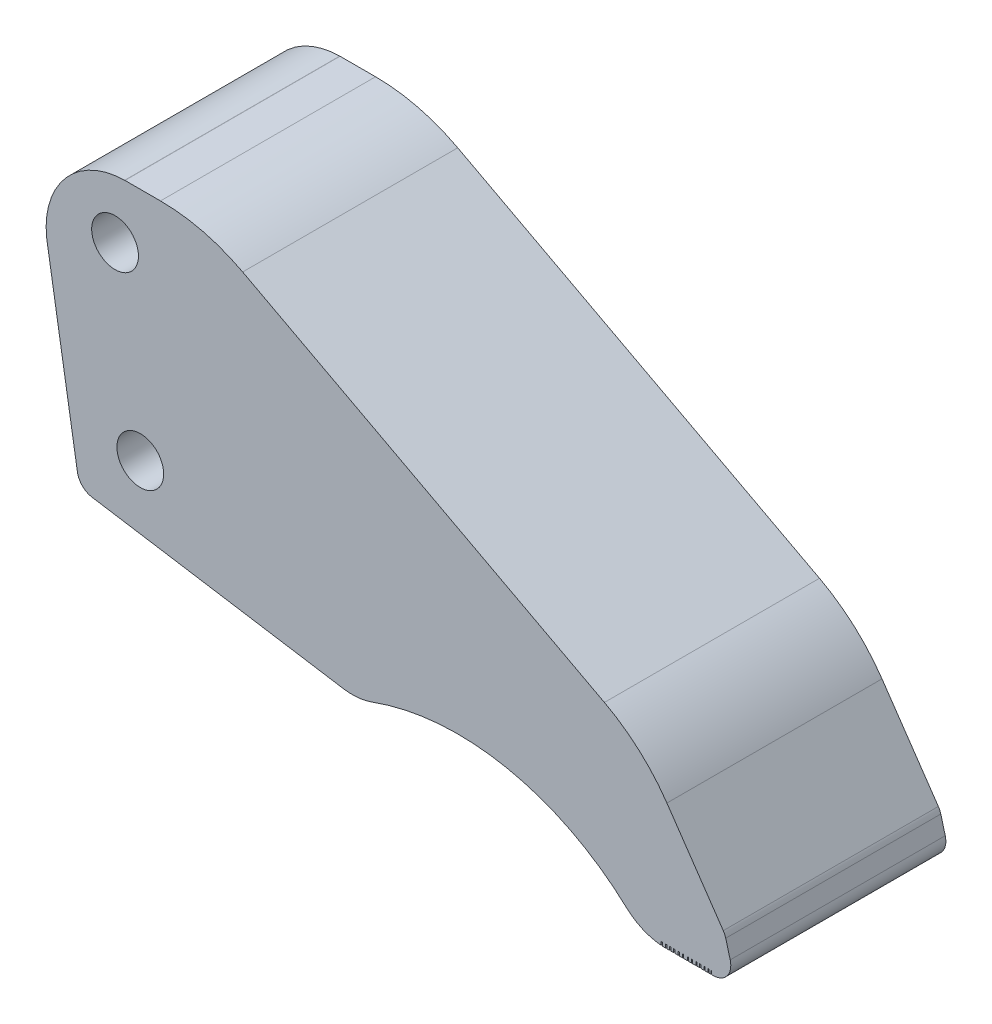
SolidWorks part; units mm, degrees
ref_plane "Front Plane" through (0, 0, 0) normal (0, 0, 1) x (1, 0, 0)
ref_plane "Top Plane" through (0, 0, 0) normal (0, 1, 0) x (1, 0, 0)
ref_plane "Right Plane" through (0, 0, 0) normal (1, 0, 0) x (0, 0, -1)
sketch "Sketch1" plane through (0, 0, 0) normal (0, 0, 1) x (1, 0, 0)
  line L0 (0, 0) -> (42.98, -6.863)
  line L1 (-2.4872, 2.4759) -> (-7.7391, 34.4271)
  line L2 (5.6424, 49.761) -> (11.7224, 49.761)
  line L3 (25.782, 46.2625) -> (87.6805, 13.4239)
  line L4 (98.3784, 3.8655) -> (108.019, -10.2215)
  line L6 (106.3066, -17.7446) -> (98.2366, -17.7446)
  line L7 (109.203, -13.963) -> (108.4396, -11.1342)
  line L8 (106.3066, -17.7446) -> (106.3066, -17.138)
  line L9 (106.3066, -17.138) -> (96.8886, -17.138)
  line L10 (96.8886, -17.138) -> (96.8886, -17.6533)
  line L12 (96.8886, -17.138) -> (97.3722, -17.138)
  line L13 (96.8886, -17.138) -> (96.8886, -17.6533)
  line L15 (97.3722, -17.138) -> (97.3722, -17.7072)
  line L16 (97.6535, -17.138) -> (98.1601, -17.138)
  line L17 (97.6535, -17.138) -> (97.6535, -17.7276)
  line L19 (98.1601, -17.138) -> (98.1601, -17.7443)
  line L20 (98.3784, -17.138) -> (98.822, -17.138)
  line L21 (98.3784, -17.138) -> (98.3784, -17.7446)
  line L22 (98.3784, -17.7446) -> (98.822, -17.7446)
  line L23 (98.822, -17.138) -> (98.822, -17.7446)
  line L24 (99.0508, -17.138) -> (99.4921, -17.138)
  line L25 (99.0508, -17.138) -> (99.0508, -17.7446)
  line L26 (99.0508, -17.7446) -> (99.4921, -17.7446)
  line L27 (99.4921, -17.138) -> (99.4921, -17.7446)
  line L28 (99.77, -17.138) -> (100.3093, -17.138)
  line L29 (99.77, -17.138) -> (99.77, -17.7446)
  line L30 (99.77, -17.7446) -> (100.3093, -17.7446)
  line L31 (100.3093, -17.138) -> (100.3093, -17.7446)
  line L32 (100.5218, -17.138) -> (101.0693, -17.138)
  line L33 (100.5218, -17.138) -> (100.5218, -17.7446)
  line L34 (100.5218, -17.7446) -> (101.0693, -17.7446)
  line L35 (101.0693, -17.138) -> (101.0693, -17.7446)
  line L36 (101.1918, -17.138) -> (101.8783, -17.138)
  line L37 (101.1918, -17.138) -> (101.1918, -17.7446)
  line L38 (101.1918, -17.7446) -> (101.8783, -17.7446)
  line L39 (101.8783, -17.138) -> (101.8783, -17.7446)
  line L40 (102.0499, -17.138) -> (102.5974, -17.138)
  line L41 (102.0499, -17.138) -> (102.0499, -17.7446)
  line L42 (102.0499, -17.7446) -> (102.5974, -17.7446)
  line L43 (102.5974, -17.138) -> (102.5974, -17.7446)
  line L44 (102.7132, -17.138) -> (103.3211, -17.138)
  line L45 (102.7132, -17.138) -> (102.7132, -17.7446)
  line L46 (102.7132, -17.7446) -> (103.3211, -17.7446)
  line L47 (103.3211, -17.138) -> (103.3211, -17.7446)
  line L48 (103.5047, -17.138) -> (103.9775, -17.138)
  line L49 (103.5047, -17.138) -> (103.5047, -17.7446)
  line L50 (103.5047, -17.7446) -> (103.9775, -17.7446)
  line L51 (103.9775, -17.138) -> (103.9775, -17.7446)
  line L52 (104.1802, -17.138) -> (104.682, -17.138)
  line L53 (104.1802, -17.138) -> (104.1802, -17.7446)
  line L54 (104.1802, -17.7446) -> (104.682, -17.7446)
  line L55 (104.682, -17.138) -> (104.682, -17.7446)
  line L56 (104.8557, -17.138) -> (105.4154, -17.138)
  line L57 (104.8557, -17.138) -> (104.8557, -17.7446)
  line L58 (104.8557, -17.7446) -> (105.4154, -17.7446)
  line L59 (105.4154, -17.138) -> (105.4154, -17.7446)
  line L60 (105.5432, -17.138) -> (105.8786, -17.138)
  line L61 (105.5432, -17.138) -> (105.5432, -17.7446)
  line L62 (105.5432, -17.7446) -> (105.8786, -17.7446)
  line L63 (105.8786, -17.138) -> (105.8786, -17.7446)
  line L64 (105.9847, -17.138) -> (106.3066, -17.138)
  line L65 (105.9847, -17.138) -> (105.9847, -17.7446)
  line L66 (105.9847, -17.7446) -> (106.3066, -17.7446)
  line L67 (106.3066, -17.138) -> (106.3066, -17.7446)
  arc A0 (0, 0) -> (-2.4872, 2.4759) centre (0.473, 2.9625) cw
  arc A1 (-7.7391, 34.4271) -> (-7.7605, 34.5823) centre (-4.7789, 34.9137) cw
  arc A4 (5.5908, 49.7606) -> (5.6424, 49.761) centre (5.6424, 46.761) cw
  arc A5 (11.7224, 49.761) -> (25.782, 46.2625) centre (11.7224, 19.761) cw
  arc A6 (87.6805, 13.4239) -> (98.3784, 3.8655) centre (73.6209, -13.0776) cw
  arc A7 (108.019, -10.2215) -> (108.4396, -11.1342) centre (105.5432, -11.9158) cw
  arc A8 (109.203, -13.963) -> (106.3066, -17.7446) centre (106.3066, -14.7446) cw
  arc A9 (98.2366, -17.7446) -> (91.4468, -15.0862) centre (98.2366, -7.7446) cw
  arc A10 (91.4468, -15.0862) -> (47.9937, -6.379) centre (62.5971, -46.2806) ccw
  arc A14 (42.98, -6.863) -> (47.9937, -6.379) centre (44.5568, 3.0119) ccw
  arc A15 (-7.7605, 34.5823) -> (-2.9945, 46.5363) centre (5.8258, 36.0926) cw
  arc A16 (-2.9945, 46.5363) -> (5.5908, 49.7606) centre (5.8258, 36.0926) cw
  circle A17 centre (3.9484, 39.6959) radius 4
  circle A18 centre (8.2675, 9.5617) radius 4
  dimension "D2" = 3
  dimension "D4" = 3
  dimension "D5" = 13.67
  dimension "D6" = 13.67
  dimension "D7" = 3
  dimension "D9" = 30
  dimension "D11" = 30
  dimension "D13" = 3
  dimension "D15" = 3
  dimension "D17" = 10
  dimension "D18" = 42.49
  dimension "D19" = 10
  dimension "D23" = 8
  dimension "D24" = 8
  dimension "D1" = 42.98
  dimension "D3" = 32.38
  dimension "D8" = 6.08
  dimension "D10" = 70.07
  dimension "D12" = 17.07
  dimension "D14" = 2.93
  dimension "D16" = 8.07
  dimension "D20" = 37.22
  dimension "D22" = 47.2851
extrude "Boss-Extrude1" add sketch "Sketch1" along normal blind 36.8 contours A16 A15 A1 L1 A0 L0 A14 A10 A9 L10 L9 L8 A8 L7 A7 L4 A6 L3 A5 L2 A4 A18 A17 | A9 L15 L9 L10 | A9 L19 L9 L17 | L23 L9 L21 L6 | L27 L9 L25 L6 | L31 L9 L29 L6 | L35 L9 L33 L6 | L39 L9 L37 L6 | L43 L9 L41 L6 | L47 L9 L45 L6 | L51 L9 L49 L6 | L55 L9 L53 L6 | L59 L9 L57 L6 | L9 L65 L6 L8 | L63 L62 L61 L60
ref_plane "Plane1" through (0, -40, 0) normal (0, 1, 0) x (1, 0, 0)
sketch "Sketch2" plane through (0, -40, 0) normal (0, 1, 0) x (1, 0, 0)
  line L0 (47.9937, -36.8) -> (91.4468, -36.8) construction
  line L1 (47.9937, -36.8) -> (91.4468, -36.8)
  line L2 (91.4468, -36.8) -> (91.4468, 0) construction
  line L3 (91.4468, 0) -> (47.9937, 0) construction
  line L4 (47.9937, -36.8) -> (47.9937, 0) construction
  line L5 (91.4468, -36.8) -> (91.4468, 0)
  line L6 (91.4468, 0) -> (47.9937, 0)
  line L7 (47.9937, -36.8) -> (47.9937, 0)
  line L8 (52.9937, -31.8) -> (86.4468, -31.8)
  line L9 (86.4468, -31.8) -> (86.4468, -5)
  line L10 (86.4468, -5) -> (52.9937, -5)
  line L11 (52.9937, -31.8) -> (52.9937, -5)
  dimension "D1" = 5
extrude "Cut-Extrude1" cut sketch "Sketch2" along normal blind 45 contours L11 L8 L9 L10
